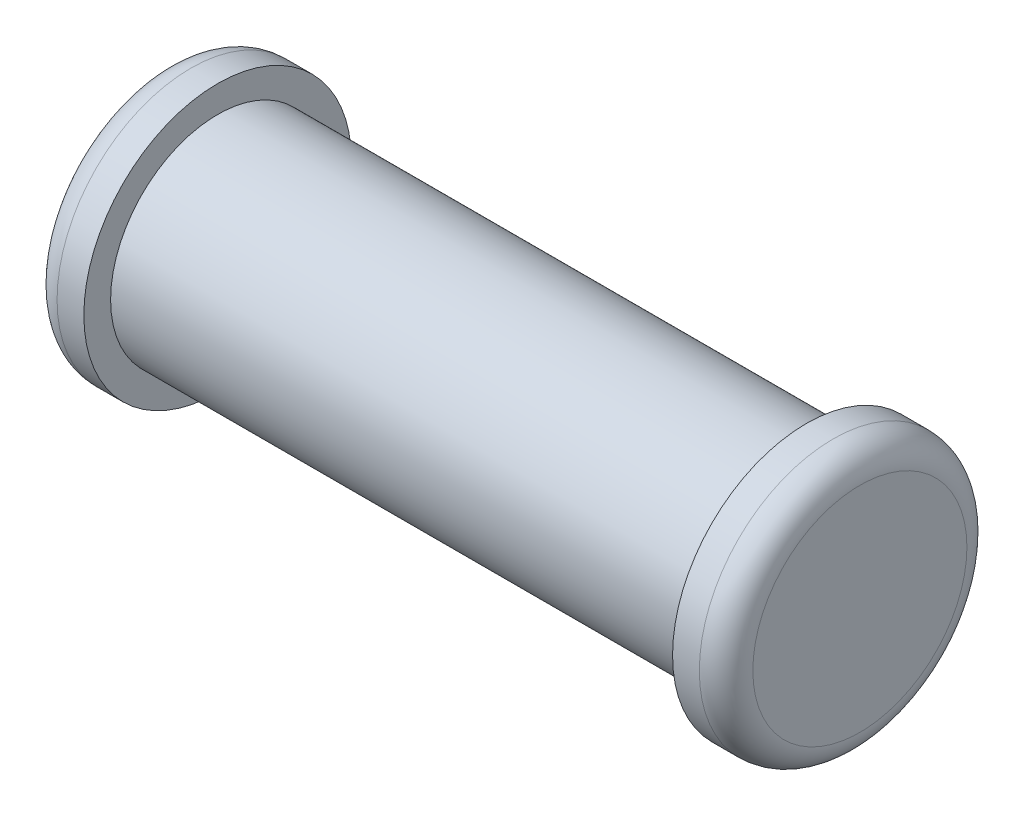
SolidWorks part; units mm, degrees
ref_plane "Front Plane" through (0, 0, 0) normal (0, 0, 1) x (1, 0, 0)
ref_plane "Top Plane" through (0, 0, 0) normal (0, 1, 0) x (1, 0, 0)
ref_plane "Right Plane" through (0, 0, 0) normal (1, 0, 0) x (0, 0, -1)
sketch "Sketch1" plane through (0, 0, 0) normal (1, 0, 0) x (0, 0, -1)
  circle A0 centre (0, 0) radius 2
  dimension "D1" = 4
extrude "Boss-Extrude1" add sketch "Sketch1" along normal blind 11
sketch "Sketch2" plane through (0, 0, 0) normal (-1, 0, 0) x (0, 0, 1)
  circle A0 centre (0, 0) radius 2.5
  dimension "D1" = 5
extrude "Boss-Extrude2" add sketch "Sketch2" along normal blind 1
fillet "Fillet1" radius 0.5 1 edges at (-1, 0, 2.5)
ref_plane "Plane1" through (5.5, 0, 0) normal (1, 0, 0) x (0, 0, -1)
mirror "Mirror1" about plane through (5.5, 0, 0) normal (1, 0, 0) of "Boss-Extrude2", "Fillet1"
